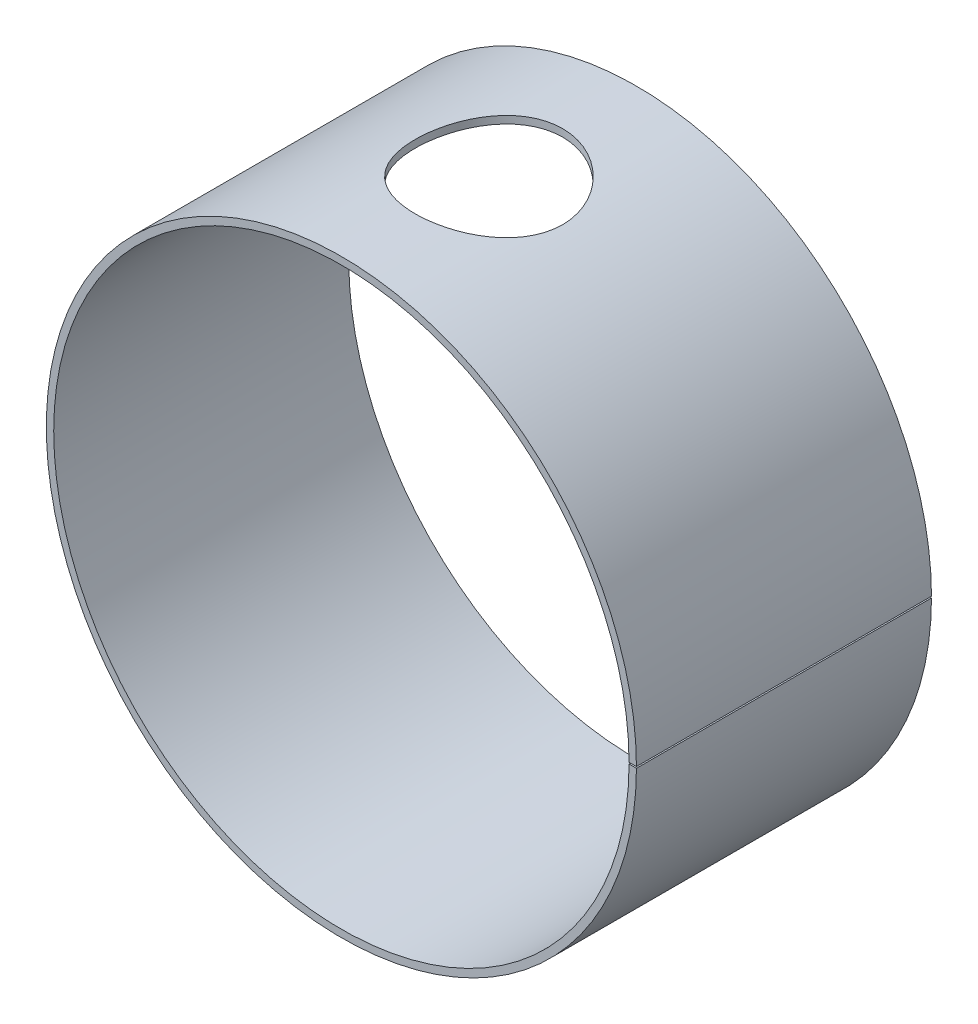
SolidWorks part; units mm, degrees
ref_plane "Ebene vorne" through (0, 0, 0) normal (0, 0, 1) x (1, 0, 0)
ref_plane "Ebene oben" through (0, 0, 0) normal (0, 1, 0) x (1, 0, 0)
ref_plane "Ebene rechts" through (0, 0, 0) normal (1, 0, 0) x (0, 0, -1)
sketch "Skizze1" plane through (0, 0, 0) normal (0, 0, 1) x (1, 0, 0)
  line L0 (0, 0) -> (42.9116, 0) construction
  line L1 (0, -0.1) -> (42.9116, -0.1) construction
  line L2 (0, 0.1) -> (42.9116, 0.1) construction
  arc A0 (39.9999, 0.1) -> (39.9999, -0.1) centre (0, 0) ccw
  dimension "D1" = 0.1
  dimension "D2" = 0.1
extrude "Linear-Austragen-Dünn1" add sketch "Skizze1" along normal blind 40 thin
sheet metal parameters "Blech1" parameters "D1"=1
bend "Biegung-Rundung1" bend radius 39
flatten bends "Abwickeln1" parameters "D1"=0, "D4"=359.714, "D5"=1
sketch "Skizze-Winkel1" plane through (39.9999, 0.1, 20) normal (1, 0.0025, 0) x (0, 0, -1)
  line L0 (-20, 123.9942) -> (20, 123.9942) construction
process bends "Abbiegen1" parameters "D1"=0
sketch "Abwicklung-Skizze1" plane through (39.9999, 0.1, 20) normal (1, 0.0025, 0) x (0, 0, -1)
other "Formnest1"
other "Rohr<1>@Baugruppe Blechteil"
